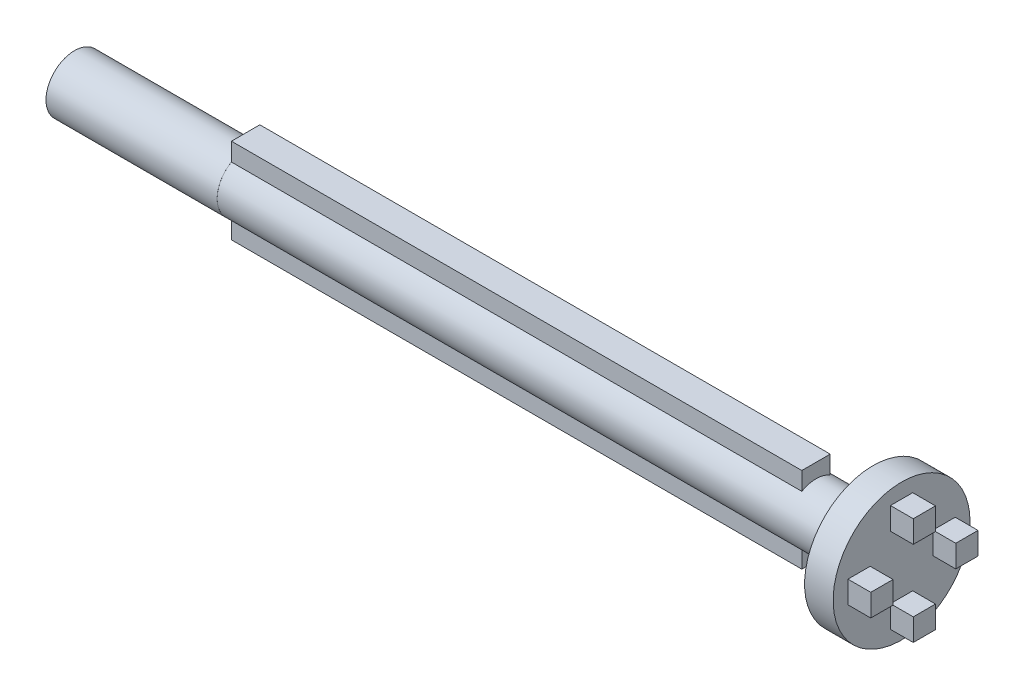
SolidWorks part; units mm, degrees
ref_plane "Front Plane" through (0, 0, 0) normal (0, 0, 1) x (1, 0, 0)
ref_plane "Top Plane" through (0, 0, 0) normal (0, 1, 0) x (1, 0, 0)
ref_plane "Right Plane" through (0, 0, 0) normal (1, 0, 0) x (0, 0, -1)
sketch "Sketch2" plane through (0, 0, 0) normal (1, 0, 0) x (0, 0, -1)
  line L1 (-2.49, 7.49) -> (2.49, 7.49)
  line L2 (-2.49, 7.49) -> (-2.49, -7.49)
  line L3 (-2.49, -7.49) -> (2.49, -7.49)
  line L4 (2.49, 7.49) -> (2.49, -7.49)
  line L5 (-2.49, 7.49) -> (2.49, -7.49) construction
  line L6 (-2.49, -7.49) -> (2.49, 7.49) construction
  circle A0 centre (0, 0) radius 4.99
  dimension "D1" = 9.98
  dimension "D2" = 4.98
  dimension "D3" = 14.98
extrude "Boss-Extrude1" add sketch "Sketch2" along normal blind 110 contours L2 A0 | L4 A0 L2 | L4 A0 | A0 L4 L1 L2 | A0 L2 L3 L4
sketch "Sketch3" plane through (110, 0, 0) normal (1, 0, 0) x (0, 0, -1)
  circle A0 centre (0, 0) radius 12
  dimension "D1" = 24
extrude "Boss-Extrude2" add sketch "Sketch3" along normal blind 5
sketch "Sketch4" plane through (115, 0, 0) normal (1, 0, 0) x (0, 0, -1)
  line L0 (0, 0) -> (1.7745, 0) construction
  line L1 (-1.95, 9.4) -> (1.95, 9.4)
  line L2 (-1.95, 9.4) -> (-1.95, 5.5)
  line L3 (-1.95, 5.5) -> (1.95, 5.5)
  line L4 (1.95, 9.4) -> (1.95, 5.5)
  line L5 (-1.95, 9.4) -> (1.95, 5.5) construction
  line L6 (-1.95, 5.5) -> (1.95, 9.4) construction
  line L7 (-1.95, -5.5) -> (1.95, -5.5)
  line L8 (1.95, -9.4) -> (1.95, -5.5)
  line L9 (-1.95, -9.4) -> (1.95, -9.4)
  line L10 (-1.95, -9.4) -> (-1.95, -5.5)
  line L11 (9.4, 1.95) -> (5.5, 1.95)
  line L12 (9.4, 1.95) -> (9.4, -1.95)
  line L13 (9.4, -1.95) -> (5.5, -1.95)
  line L14 (5.5, 1.95) -> (5.5, -1.95)
  line L15 (1.95, -9.4) -> (1.95, -5.5)
  line L16 (1.95, -9.4) -> (-1.95, -9.4)
  line L17 (-1.95, -9.4) -> (-1.95, -5.5)
  line L18 (1.95, -5.5) -> (-1.95, -5.5)
  line L19 (-9.4, -1.95) -> (-5.5, -1.95)
  line L20 (-9.4, -1.95) -> (-9.4, 1.95)
  line L21 (-9.4, 1.95) -> (-5.5, 1.95)
  line L22 (-5.5, -1.95) -> (-5.5, 1.95)
  circle A0 centre (0, 0) radius 7.45 construction
  point P0 (0, 7.45)
  point P29 (0, 0)
  dimension "D1" = 3.9
  dimension "D2" = 11
  dimension "D3" = 4
extrude "Boss-Extrude3" add sketch "Sketch4" along normal blind 4 contours L4 L1 L2 L3 | L19 L22 L21 L20 | L10 L9 L8 L7 | L11 L14 L13 L12
sketch "Sketch5" plane through (0, 0, 0) normal (-1, 0, 0) x (0, 0, 1)
  circle A0 centre (0, 0) radius 5
  dimension "D1" = 10
extrude "Boss-Extrude4" add sketch "Sketch5" along normal blind 30
ref_plane "Plane1" through (100, 0, 0) normal (-1, 0, 0) x (0, 0, 1)
sketch "Sketch7" plane through (100, 0, 0) normal (-1, 0, 0) x (0, 0, 1)
  line L1 (-2.49, 7.49) -> (2.49, 7.49)
  line L2 (-2.49, 7.49) -> (-2.49, -7.49)
  line L3 (-2.49, -7.49) -> (2.49, -7.49)
  line L4 (2.49, 7.49) -> (2.49, -7.49)
  line L5 (-2.49, 7.49) -> (2.49, -7.49) construction
  line L6 (-2.49, -7.49) -> (2.49, 7.49) construction
  circle A0 centre (0, 0) radius 4.99
  dimension "D1" = 9.98
  dimension "D2" = 4.98
  dimension "D3" = 14.98
extrude "Cut-Extrude1" cut sketch "Sketch7" against normal up to surface (10 mm away) contours A0 L4 L1 L2 | A0 L2 L3 L4
